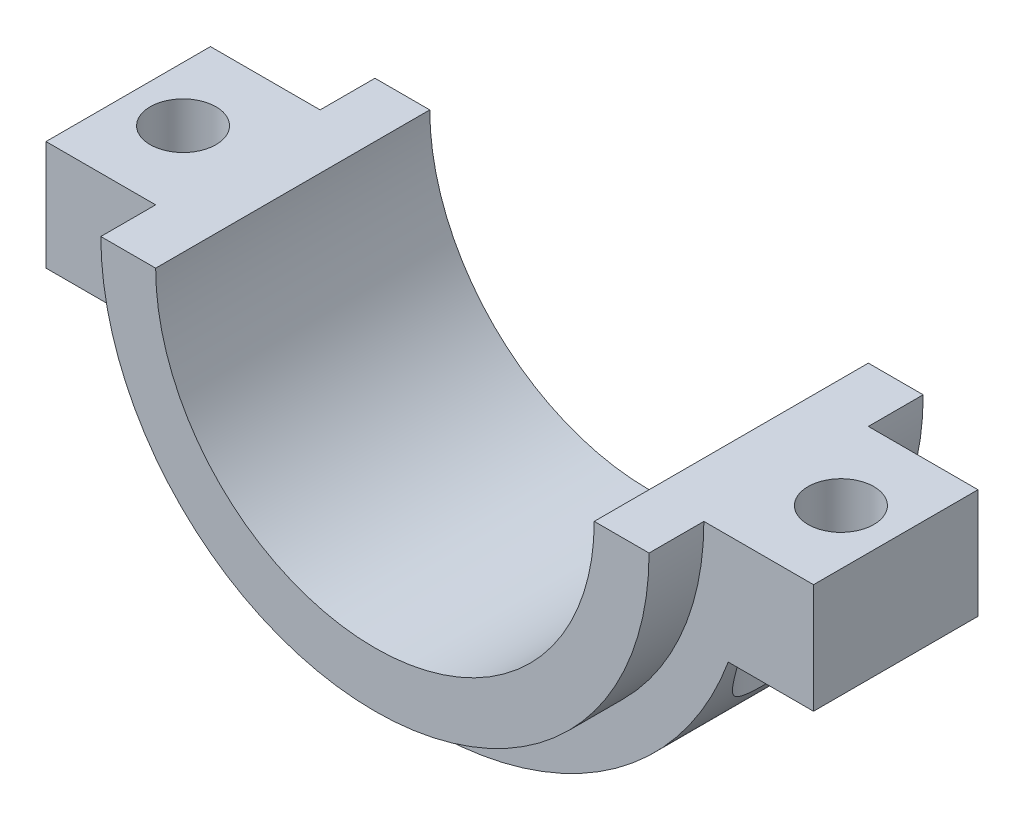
SolidWorks part; units mm, degrees
ref_plane "Płaszczyzna przednia" through (0, 0, 0) normal (0, 0, 1) x (1, 0, 0)
ref_plane "Płaszczyzna górna" through (0, 0, 0) normal (0, 1, 0) x (1, 0, 0)
ref_plane "Płaszczyzna prawa" through (0, 0, 0) normal (1, 0, 0) x (0, 0, -1)
sketch "Szkic1" plane through (0, 0, 0) normal (0, 0, 1) x (1, 0, 0)
  line L0 (40, 0) -> (70, 0)
  line L1 (-70, 0) -> (-40, 0)
  line L2 (-70, 0) -> (-70, -20)
  line L3 (-70, -20) -> (-54.4426, -20)
  line L4 (70, 0) -> (70, -20)
  line L5 (54.4426, -20) -> (70, -20)
  arc A0 (-54.4426, -20) -> (54.4426, -20) centre (0, 0) ccw
  arc A1 (-40, 0) -> (40, 0) centre (0, 0) ccw
  dimension "D1" = 40
  dimension "D2" = 58
  dimension "D3" = 140
  dimension "D4" = 20
extrude "Dodanie-wyciągnięcie1" add sketch "Szkic1" along normal mid plane 30
sketch "Szkic2" plane through (0, 0, 0) normal (0, 0, 1) x (1, 0, 0)
  line L0 (70, 0) -> (40, 0) construction
  line L1 (-40, 0) -> (-70, 0) construction
  line L2 (50, 0) -> (40, 0)
  line L3 (-40, 0) -> (-50, 0)
  arc A0 (-40, 0) -> (40, 0) centre (0, 0) ccw construction
  arc A1 (-40, 0) -> (40, 0) centre (0, 0) ccw
  arc A2 (-50, 0) -> (50, 0) centre (0, 0) ccw
  dimension "D1" = 50
extrude "Dodanie-wyciągnięcie2" add sketch "Szkic2" along normal mid plane 50
sketch "Szkic3" plane through (0, -20, 0) normal (0, -1, 0) x (1, 0, 0)
  line L0 (0, 0) -> (0, 25) construction
  line L1 (50, 25) -> (-50, 25) construction
  circle A0 centre (-60, 0) radius 6
  point P7 (0, 0)
  dimension "D1" = 12
  dimension "D2" = 120
extrude "Wytnij-wyciągnięcie1" cut sketch "Szkic3" against normal through all
sketch "Szkic4" plane through (0, -20, 0) normal (0, -1, 0) x (1, 0, 0)
  circle A0 centre (-60, 0) radius 14
  dimension "D1" = 14
extrude "Wytnij-wyciągnięcie2" cut sketch "Szkic4" along normal through all
mirror "Lustro1" about plane through (0, 0, 0) normal (1, 0, 0) of "Wytnij-wyciągnięcie2", "Wytnij-wyciągnięcie1"
